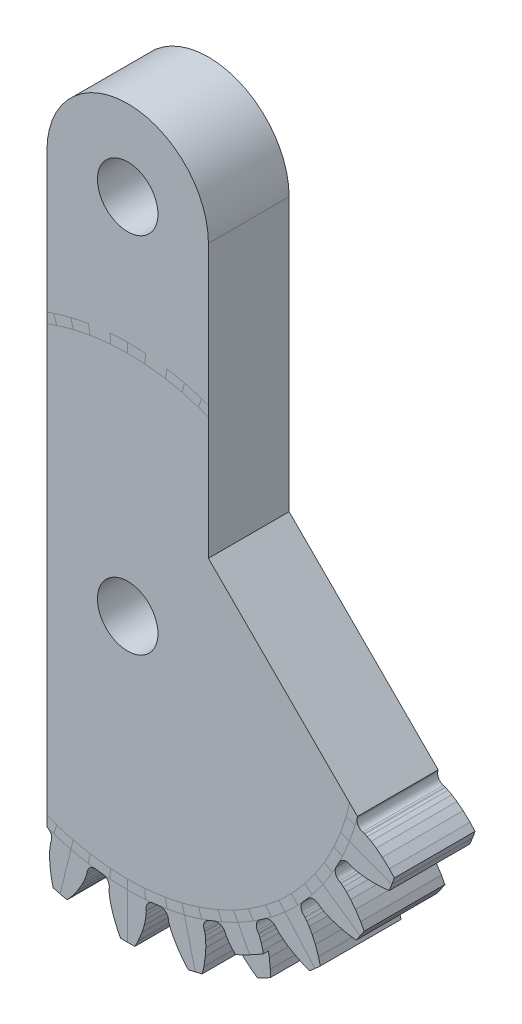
SolidWorks part; units mm, degrees
ref_plane "Plan1" through (0, 0, 0) normal (0, 0, 1) x (1, 0, 0)
ref_plane "Plan2" through (0, 0, 0) normal (0, 1, 0) x (1, 0, 0)
ref_plane "Plan3" through (0, 0, 0) normal (1, 0, 0) x (0, 0, -1)
imported_body "Importée1"
sketch "Esquisse1" plane through (0, 0, 0) normal (0, 0, 1) x (1, 0, 0)
  circle A0 centre (0, 0) radius 21.62
  circle A1 centre (0, 0) radius 21.62 construction
extrude "bouchon" add sketch "Esquisse1" against normal up to surface (8 mm away)
sketch "Esquisse2" plane through (0, 0, -8) normal (0, 0, -1) x (-1, 0, 0)
  line L0 (0, -1) -> (0, 15) construction
  line L1 (-8, 0) -> (8, 0)
  line L2 (-8, 0) -> (-8, 36)
  line L4 (8, 0) -> (8, 36)
  arc A0 (8, 36) -> (-8, 36) centre (0, 36) ccw
  dimension "D1" = 16
  dimension "D3" = 36
extrude "corps" add sketch "Esquisse2" against normal up to surface (8 mm away)
sketch "Esquisse3" plane through (0, 0, 0) normal (0, 0, 1) x (1, 0, 0)
  line L0 (-8, 44) -> (-8, -32)
  line L1 (-8, 22.0978) -> (-8, 36) construction
extrude "decoupe secteur 1" cut sketch "Esquisse3" against normal through all and the other way through all flip side to cut
sketch "Esquisse4" plane through (0, 0, 0) normal (0, 0, 1) x (1, 0, 0)
  line L0 (8, 44) -> (8, 8.9706)
  line L1 (8, 8.9706) -> (23.1822, -6.2117)
  line L2 (8, 36) -> (8, 22.0978) construction
  line L3 (8, 44) -> (30, 44)
  line L4 (23.1822, -6.2117) -> (30, -6.2117)
  line L5 (30, -6.2117) -> (30, 44)
  arc A0 (8, 36) -> (-8, 36) centre (0, 36) ccw construction
  dimension "D1" = 24
  dimension "D2" = 45
  dimension "D3" = 12
  dimension "D4" = 22
extrude "decoupe secteur 2" cut sketch "Esquisse4" against normal through all
hole_wizard "passage axe" positions "Esquisse6" profile "Esquisse5" hole size "M6.0" standard "ISO"
sketch "Esquisse6" plane through (0, 0, 0) normal (0, 0, 1) x (1, 0, 0)
  line L0 (0, 36) -> (0, 0) construction
  point P0 (0, 0)
  point P1 (0, 36)
  dimension "D1" = 36
sketch "Esquisse5" plane through (0, 0, 0) normal (1, 0, 0) x (0, -1, 0)
  line L0 (0, 0) -> (0, 8)
  line L1 (0, 8) -> (3, 8)
  line L2 (3, 8) -> (3, 0)
  line L5 (3, 0) -> (0, 0)
  line L11 (0, -6.35) -> (0, 107.95) construction
  dimension "Diamètre du perçage jusqu'au prochain" = 6
  dimension "Profondeur du perçage jusqu'au prochain" = 8
sketch "Esquisse8" plane through (0, 0, -8) normal (0, 0, -1) x (-1, 0, 0)
  arc A0 (-22.6318, -16.4864) -> (-19.2961, -15.5377) centre (-23.7122, -6.3484) ccw
  point P0 (-22.6318, -16.4864)
  point P1 (-21.9053, -16.3895)
  point P3 (-20.9801, -16.1861)
  point P5 (-20.2396, -15.9571)
  point P7 (-19.6806, -15.7315)
  point P9 (-19.2961, -15.5377)
sketch "Esquisse9" plane through (0, 0, -8) normal (0, 0, -1) x (-1, 0, 0)
  arc A0 (-13.6382, -24.454) -> (-13.2445, -21.4334) centre (-4.3975, -24.1223) cw
  point P0 (-13.6382, -24.454)
  point P1 (-13.6296, -23.7211)
  point P3 (-13.5392, -22.7781)
  point P5 (-13.4011, -22.0155)
  point P7 (-13.2445, -21.4334)
surface "Surface glissement" sketch "Esquisse9" parameters "D1"=10
sketch "Esquisse10" plane through (0, 0, 0) normal (0, 0, 1) x (1, 0, 0)
  line L16 (10.599, -23.7415) -> (11.9333, -26)
  line L17 (11.9333, -26) -> (14.8457, -24.2794)
  line L18 (14.8457, -24.2794) -> (13.5632, -22.1819)
  arc A0 (10.599, -23.7415) -> (13.5632, -22.1819) centre (0, 0) ccw
  dimension "D1" = 26
extrude "Enlèv. mat.-Extru.1" cut sketch "Esquisse10" against normal blind 0.5
